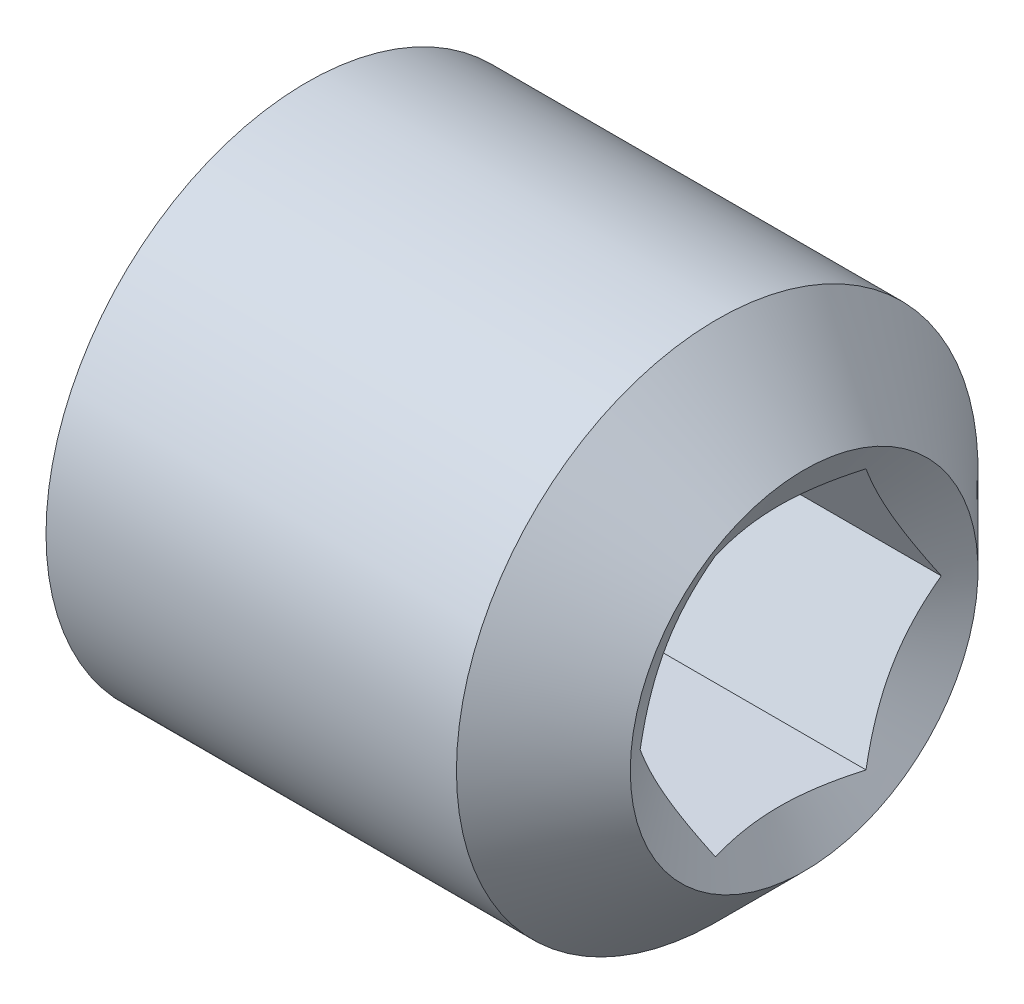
SolidWorks part; units mm, degrees
ref_plane "Plane1" through (0, 0, 0) normal (0, 0, 1) x (1, 0, 0)
ref_plane "Plane2" through (0, 0, 0) normal (0, 1, 0) x (1, 0, 0)
ref_plane "Plane3" through (0, 0, 0) normal (1, 0, 0) x (0, 0, -1)
sketch "BodySke" plane through (0, 0, 0) normal (0, 0, 1) x (1, 0, 0)
  line L0 (0, 0) -> (0, 5.036)
  line L1 (0, 5.036) -> (0.5566, 6)
  line L2 (0.5566, 6) -> (10, 6)
  line L3 (10, 6) -> (12, 4)
  line L4 (9.6906, 0) -> (0, 0)
  line L5 (-12.7, 0) -> (88.9, 0) construction
  line L6 (9.6906, 0) -> (12, 4)
  line L7 (12, 4) -> (12, 13.525) construction
  line L8 (0, -5.036) -> (0.5566, -6) construction
  line L9 (9.6906, 0) -> (12, -4) construction
  line L10 (10, -6) -> (12, -4) construction
  line L11 (0.875, 15.875) -> (0.875, -3.175) construction
  dimension "Length" = 12
  dimension "Diameter" = 12
  dimension "Drive_ch_ang" = 60
  dimension "Minor_dia" = 10.072
  dimension "Cup_nose_ang" = 45
  dimension "Cup_ang" = 120
  dimension "Cup_dia" = 8
  dimension "Advance" = 1.75
revolve "BaseBody" add sketch "BodySke" angle 360 about L5
sketch "Sketch2" plane through (0, 0, 0) normal (-1, 0, 0) x (0, 0, 1)
  line L0 (1.7321, 3) -> (-1.7321, 3)
  line L1 (-1.7321, 3) -> (-3.4641, 0)
  line L2 (1.7321, 3) -> (3.4641, 0)
  line L3 (1.7321, -3) -> (3.4641, 0)
  line L4 (1.7321, -3) -> (-1.7321, -3)
  line L5 (-1.7321, -3) -> (-3.4641, 0)
  dimension "Hex_size" = 6
  dimension "D2" = 3
  dimension "D3" = 3
extrude "Hex" cut sketch "Sketch2" against normal through all
sketch "ThdSchSke" plane through (0, 0, 0) normal (0, 0, 1) x (1, 0, 0)
  line L0 (0.5566, -5.036) -> (-0.1184, -6)
  line L1 (0.5566, -5.036) -> (1.2316, -6)
  line L2 (1.2316, -6) -> (1.2316, -7.5)
  line L3 (-3.175, 0) -> (5.1513, 0) construction
  line L4 (0.5566, 6) -> (0.5566, -6) construction
  line L5 (1.2316, -7.5) -> (-0.1184, -7.5)
  line L6 (-0.1184, -7.5) -> (-0.1184, -6)
  dimension "Thread_minor" = 10.072
  dimension "Diameter" = 12
  dimension "SideAngle" = 55
  dimension "VeeAngle" = 70
  dimension "Overcut" = 15
revolve "ThreadSchematic" [suppressed] cut sketch "ThdSchSke" angle 360 about L3
pattern_linear "ThdSchPat" [suppressed]
equation "\"D2@Sketch2\" = \"Hex_size@Sketch2\" / 2"
equation "\"D3@Sketch2\" = \"Hex_size@Sketch2\" / 2"
equation "\"Thread_minor@ThreadCosmetic\" = \"Minor_dia@BodySke\""
equation "\"Thread_minor@ThdSchSke\" = \"Thread_minor@ThreadCosmetic\""
equation "\"Diameter@ThdSchSke\" = \"Diameter@BodySke\""
equation "\"Overcut@ThdSchSke\" = \"Diameter@BodySke\" * 1.25"
equation "\"Num_threads@ThdSchPat\" = int( (\"Length@BodySke\" - ( ( ( \"Diameter@BodySke\" - \"Minor_dia@BodySke\" ) * 0.5 ) / tan( \"Drive_ch_ang@BodySke\" * 0.017453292 ) ) - ( ( ( \"Diameter@BodySke\" - \"Cup_dia@BodySk"
equation "\"Advance@ThdSchPat\" = (\"Length@BodySke\" - ( ( ( \"Diameter@BodySke\" - \"Minor_dia@BodySke\" ) * 0.5 ) / tan( \"Drive_ch_ang@BodySke\" * 0.017453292 ) ) - ( ( ( \"Diameter@BodySke\" - \"Cup_dia@BodySke\" ) * 0."
equation "' \"Num_threads@ThdSchPat\" = \"Num_threads@ThdSchPat\" - sgn( \"Num_threads@ThdSchPat\" - 1) '---chamfered tips only---"
